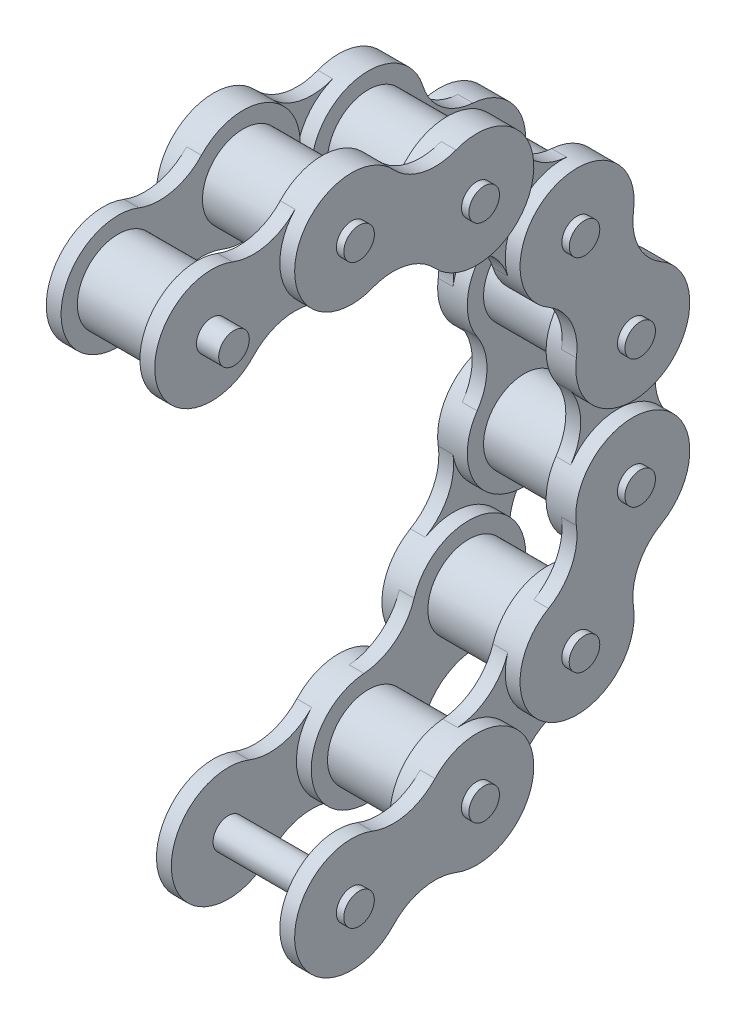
SolidWorks part; units mm, degrees
ref_plane "Plan de face" through (0, 0, 0) normal (0, 0, 1) x (1, 0, 0)
ref_plane "Plan de dessus" through (0, 0, 0) normal (0, 1, 0) x (1, 0, 0)
ref_plane "Plan de droite" through (0, 0, 0) normal (1, 0, 0) x (0, 0, -1)
ref_plane "Plan1" through (5.55, 0, 0) normal (1, 0, 0) x (0, 0, -1)
sketch "Esquisse2" plane through (5.55, 0, 0) normal (1, 0, 0) x (0, 0, -1)
  line L0 (0, 0) -> (34.75, 43.5729) construction
  line L1 (0, 0) -> (55.733, -0.0028) construction
  line L2 (0, 0) -> (34.7457, -43.5764) construction
  line L42 (0, 0) -> (-18.5724, 38.5659) construction
  line L43 (0, 0) -> (0, 42.805) construction
  line L44 (0, 0) -> (-12.4018, 54.3356) construction
  circle A0 centre (0, 0) radius 42.805 construction
  arc A1 (26.6617, 41.0692) -> (17.9318, 30.1228) centre (18.5733, 38.5655) ccw
  arc A2 (26.6617, 41.0692) -> (34.1085, 35.1303) centre (34.75, 43.5729) ccw
  arc A3 (25.3786, 24.1839) -> (34.1085, 35.1303) centre (33.4669, 26.6876) ccw
  arc A4 (25.3786, 24.1839) -> (17.9318, 30.1228) centre (17.2902, 21.6802) ccw
  arc A5 (48.7326, 4.7601) -> (34.7314, 4.7608) centre (41.7322, 9.5229) ccw
  arc A6 (48.7326, 4.7601) -> (48.7321, -4.7649) centre (55.733, -0.0028) ccw
  arc A7 (34.7309, -4.7642) -> (48.7321, -4.7649) centre (41.7313, -9.5271) ccw
  arc A8 (34.7309, -4.7642) -> (34.7314, 4.7608) centre (27.7305, -0.0014) ccw
  arc A9 (34.105, -35.1337) -> (25.3762, -24.1864) centre (33.4643, -26.691) ccw
  arc A10 (34.105, -35.1337) -> (26.6576, -41.0719) centre (34.7457, -43.5764) ccw
  arc A11 (17.9288, -30.1246) -> (26.6576, -41.0719) centre (18.5695, -38.5673) ccw
  arc A12 (17.9288, -30.1246) -> (25.3762, -24.1864) centre (17.2881, -21.6819) ccw
  arc A15 (-3.0853, 34.9201) -> (-6.2009, 48.5703) centre (0, 42.805) ccw
  arc A16 (-15.4871, 46.4508) -> (-12.3715, 32.8006) centre (-18.5724, 38.5659) ccw
  arc A17 (-15.4871, 46.4508) -> (-6.2009, 48.5703) centre (-12.4018, 54.3356) ccw
  arc A18 (-3.0853, 34.9201) -> (-12.3715, 32.8006) centre (-6.1706, 27.0352) ccw
  dimension "D1" = 4
  dimension "D2" = 51.43
  dimension "D4" = 51.43
  dimension "D5" = 51.43
extrude "Boss.-Extru.1" add sketch "Esquisse2" along normal blind 2.202
sketch "Esquisse3" plane through (7.752, 0, 0) normal (1, 0, 0) x (0, 0, -1)
  circle A0 centre (-18.5724, 38.5659) radius 6.05
  circle A1 centre (0, 42.805) radius 6.05
  circle A2 centre (18.5733, 38.5655) radius 6.05
  circle A3 centre (33.4669, 26.6876) radius 6.05
  circle A4 centre (41.7322, 9.5229) radius 6.05
  circle A5 centre (41.7313, -9.5271) radius 6.05
  circle A6 centre (33.4643, -26.691) radius 6.05
  circle A7 centre (18.5695, -38.5673) radius 6.05
  arc A8 (-15.4871, 46.4508) -> (-12.3715, 32.8006) centre (-18.5724, 38.5659) ccw construction
  arc A9 (26.6617, 41.0692) -> (17.9318, 30.1228) centre (18.5733, 38.5655) ccw construction
  dimension "D1" = 12.1
  dimension "D2" = 12.1
  dimension "D3" = 4
extrude "Boss.-Extru.2" add sketch "Esquisse3" along normal blind 11.7
sketch "Esquisse9" plane through (19.452, 0, 0) normal (1, 0, 0) x (0, 0, -1)
  line L0 (0, 0) -> (-6.1706, 27.0352) construction
  line L1 (0, 0) -> (17.2902, 21.6802) construction
  arc A0 (-15.4871, 46.4508) -> (-12.3715, 32.8006) centre (-18.5724, 38.5659) ccw
  arc A1 (-3.0853, 34.9201) -> (-6.2009, 48.5703) centre (0, 42.805) ccw
  arc A2 (-3.0853, 34.9201) -> (-12.3715, 32.8006) centre (-6.1706, 27.0352) ccw
  arc A3 (-15.4871, 46.4508) -> (-6.2009, 48.5703) centre (-12.4018, 54.3356) ccw
  arc A4 (25.3786, 24.1839) -> (34.1085, 35.1303) centre (33.4669, 26.6876) ccw
  arc A5 (26.6617, 41.0692) -> (34.1085, 35.1303) centre (34.75, 43.5729) ccw
  arc A6 (26.6617, 41.0692) -> (17.9318, 30.1228) centre (18.5733, 38.5655) ccw
  arc A7 (25.3786, 24.1839) -> (17.9318, 30.1228) centre (17.2902, 21.6802) ccw
  arc A8 (34.7309, -4.7642) -> (48.7321, -4.7649) centre (41.7313, -9.5271) ccw
  arc A9 (48.7326, 4.7601) -> (48.7321, -4.7649) centre (55.733, -0.0028) ccw
  arc A10 (48.7326, 4.7601) -> (34.7314, 4.7608) centre (41.7322, 9.5229) ccw
  arc A11 (34.7309, -4.7642) -> (34.7314, 4.7608) centre (27.7305, -0.0014) ccw
  arc A12 (17.9288, -30.1246) -> (26.6576, -41.0719) centre (18.5695, -38.5673) ccw
  arc A13 (34.105, -35.1337) -> (26.6576, -41.0719) centre (34.7457, -43.5764) ccw
  arc A14 (34.105, -35.1337) -> (25.3762, -24.1864) centre (33.4643, -26.691) ccw
  arc A15 (17.9288, -30.1246) -> (25.3762, -24.1864) centre (17.2881, -21.6819) ccw
  dimension "D1" = 51.43
extrude "Boss.-Extru.5" add sketch "Esquisse9" along normal blind 2.202
sketch "Esquisse10" plane through (21.654, 0, 0) normal (1, 0, 0) x (0, 0, -1)
  circle A0 centre (-18.5724, 38.5659) radius 2.269
  circle A1 centre (0, 42.805) radius 2.269
  circle A2 centre (18.5733, 38.5655) radius 2.269
  circle A3 centre (33.4669, 26.6876) radius 2.269
  circle A4 centre (41.7322, 9.5229) radius 2.269
  circle A5 centre (41.7313, -9.5271) radius 2.269
  circle A6 centre (33.4643, -26.691) radius 2.269
  circle A7 centre (18.5695, -38.5673) radius 2.269
  dimension "D1" = 4.538
  dimension "D2" = 4.538
  dimension "D3" = 4
extrude "Boss.-Extru.6" add sketch "Esquisse10" along normal blind 3.303 and the other way blind 19.407
sketch "Esquisse11" plane through (21.654, 0, 0) normal (1, 0, 0) x (0, 0, -1)
  arc A0 (6.2012, 48.57) -> (3.0855, 34.9202) centre (0, 42.805) ccw
  arc A1 (12.3722, 32.8004) -> (15.4878, 46.4503) centre (18.5733, 38.5655) ccw
  arc A2 (12.3722, 32.8004) -> (3.0855, 34.9202) centre (6.171, 27.0354) ccw
  arc A3 (6.2012, 48.57) -> (15.4878, 46.4503) centre (12.4023, 54.335) ccw
  arc A4 (41.8406, 25.4336) -> (29.226, 19.3593) centre (33.4669, 26.6876) ccw
  arc A5 (33.3586, 10.777) -> (29.226, 19.3593) centre (24.985, 12.031) ccw
  arc A6 (41.8406, 25.4336) -> (45.9732, 16.8512) centre (50.2142, 24.1796) ccw
  arc A7 (33.3586, 10.777) -> (45.9732, 16.8512) centre (41.7322, 9.5229) ccw
  arc A8 (45.9715, -16.8558) -> (33.3575, -10.7803) centre (41.7313, -9.5271) ccw
  arc A9 (29.224, -19.3622) -> (33.3575, -10.7803) centre (24.9838, -12.0335) ccw
  arc A10 (45.9715, -16.8558) -> (41.838, -25.4378) centre (50.2118, -24.1846) ccw
  arc A11 (29.224, -19.3622) -> (41.838, -25.4378) centre (33.4643, -26.691) ccw
  arc A12 (15.4832, -46.4518) -> (12.3689, -32.8017) centre (18.5695, -38.5673) ccw
  arc A13 (3.082, -34.9205) -> (12.3689, -32.8017) centre (6.1683, -27.036) ccw
  arc A14 (15.4832, -46.4518) -> (6.1963, -48.5706) centre (12.3969, -54.3363) ccw
  arc A15 (3.082, -34.9205) -> (6.1963, -48.5706) centre (-0.0043, -42.805) ccw
  circle A16 centre (0, 42.805) radius 2.269 construction
  dimension "D1" = 16.934
  dimension "D2" = 16.934
extrude "Boss.-Extru.7" add sketch "Esquisse11" along normal blind 2.202
sketch "Esquisse12" plane through (5.55, 0, 0) normal (-1, 0, 0) x (0, 0, 1)
  arc A0 (-3.0855, 34.9202) -> (-6.2012, 48.57) centre (0, 42.805) ccw
  arc A1 (-45.9732, 16.8512) -> (-41.8406, 25.4336) centre (-50.2142, 24.1796) ccw
  arc A2 (-15.4878, 46.4503) -> (-12.3722, 32.8004) centre (-18.5733, 38.5655) ccw
  arc A3 (-3.0855, 34.9202) -> (-12.3722, 32.8004) centre (-6.171, 27.0354) ccw
  arc A4 (-15.4878, 46.4503) -> (-6.2012, 48.57) centre (-12.4023, 54.335) ccw
  arc A5 (-29.226, 19.3593) -> (-41.8406, 25.4336) centre (-33.4669, 26.6876) ccw
  arc A6 (-29.226, 19.3593) -> (-33.3586, 10.777) centre (-24.985, 12.031) ccw
  arc A7 (-45.9732, 16.8512) -> (-33.3586, 10.777) centre (-41.7322, 9.5229) ccw
  arc A8 (-41.838, -25.4378) -> (-45.9715, -16.8558) centre (-50.2118, -24.1846) ccw
  arc A9 (-33.3575, -10.7803) -> (-45.9715, -16.8558) centre (-41.7313, -9.5271) ccw
  arc A10 (-33.3575, -10.7803) -> (-29.224, -19.3622) centre (-24.9838, -12.0335) ccw
  arc A11 (-41.838, -25.4378) -> (-29.224, -19.3622) centre (-33.4643, -26.691) ccw
  arc A12 (-6.1963, -48.5706) -> (-15.4832, -46.4518) centre (-12.3969, -54.3363) ccw
  arc A13 (-12.3689, -32.8017) -> (-15.4832, -46.4518) centre (-18.5695, -38.5673) ccw
  arc A14 (-12.3689, -32.8017) -> (-3.082, -34.9205) centre (-6.1683, -27.036) ccw
  arc A15 (-6.1963, -48.5706) -> (-3.082, -34.9205) centre (0.0043, -42.805) ccw
extrude "Boss.-Extru.8" add sketch "Esquisse12" along normal blind 2.202
sketch "Esquisse13" plane through (23.856, 0, 0) normal (1, 0, 0) x (0, 0, -1)
  circle A0 centre (-0.0043, -42.805) radius 2.269
  dimension "D1" = 4.538
extrude "Boss.-Extru.9" add sketch "Esquisse13" along normal blind 1.1 and the other way blind 21.609
